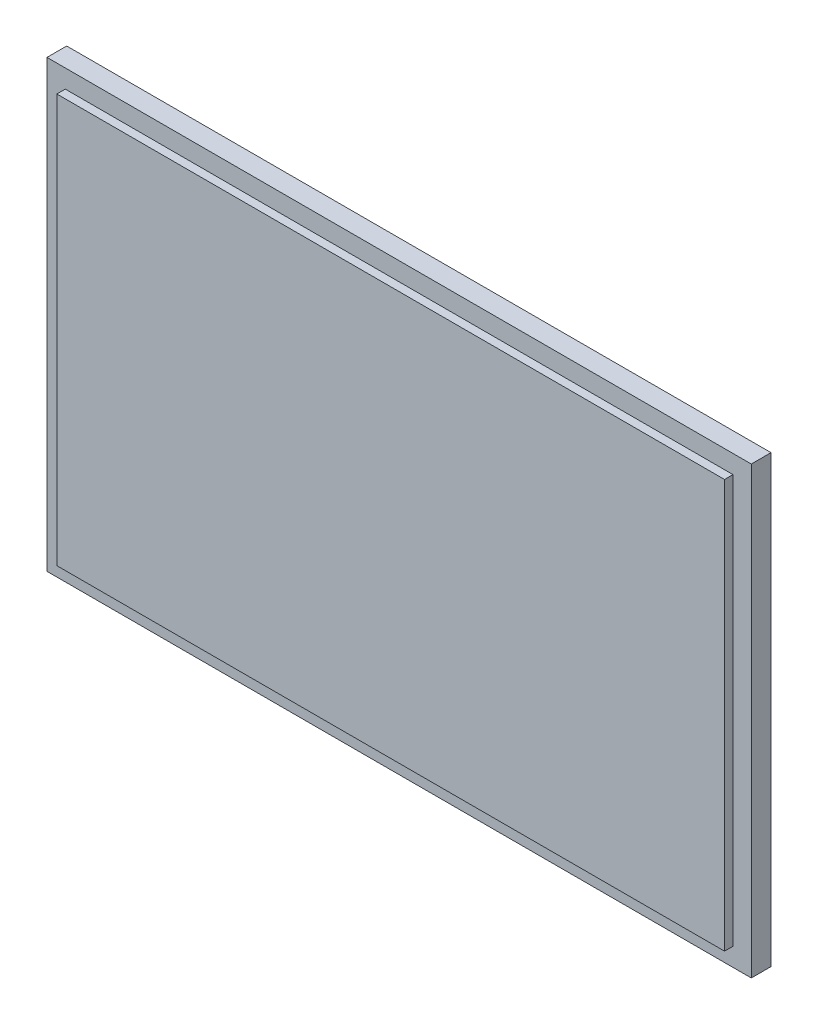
SolidWorks part; units mm, degrees
ref_plane "Plan de face" through (0, 0, 0) normal (0, 0, 1) x (1, 0, 0)
ref_plane "Plan de dessus" through (0, 0, 0) normal (0, 1, 0) x (1, 0, 0)
ref_plane "Plan de droite" through (0, 0, 0) normal (1, 0, 0) x (0, 0, -1)
sketch "Esquisse1" plane through (0, 0, 0) normal (0, 0, 1) x (1, 0, 0)
  line L1 (-98.7408, 66.9983) -> (151.2592, 66.9983)
  line L2 (-98.7408, 66.9983) -> (-98.7408, -91.0017)
  line L3 (-98.7408, -91.0017) -> (151.2592, -91.0017)
  line L4 (151.2592, 66.9983) -> (151.2592, -91.0017)
  dimension "D1" = 250
  dimension "D2" = 158
extrude "Boss.-Extru.1" add sketch "Esquisse1" along normal blind 10
sketch "Esquisse3" plane through (0, 0, 10) normal (0, 0, 1) x (1, 0, 0)
  line L0 (151.2592, -91.0017) -> (151.2592, 66.9983) construction
  line L1 (-98.7408, 66.9983) -> (151.2592, 66.9983)
  line L2 (-98.7408, 66.9983) -> (-98.7408, 60.4983)
  line L3 (-98.7408, 60.4983) -> (151.2592, 60.4983)
  line L4 (151.2592, 66.9983) -> (151.2592, 60.4983)
  dimension "D1" = 6.5
extrude "Enlèv. mat.-Extru.1" cut sketch "Esquisse3" against normal blind 3
sketch "Esquisse4" plane through (0, 0, 10) normal (0, 0, 1) x (1, 0, 0)
  line L0 (-98.7408, 60.4983) -> (-98.7408, -91.0017) construction
  line L1 (151.2592, -91.0017) -> (-98.7408, -91.0017)
  line L2 (151.2592, -91.0017) -> (151.2592, -84.5017)
  line L3 (151.2592, -84.5017) -> (-98.7408, -84.5017)
  line L4 (-98.7408, -91.0017) -> (-98.7408, -84.5017)
  dimension "D1" = 6.5
extrude "Enlèv. mat.-Extru.2" cut sketch "Esquisse4" against normal blind 3
sketch "Esquisse5" plane through (0, 0, 10) normal (0, 0, 1) x (1, 0, 0)
  line L0 (151.2592, -84.5017) -> (-98.7408, -84.5017) construction
  line L1 (-98.7408, 60.4983) -> (-92.2408, 60.4983)
  line L2 (-98.7408, 60.4983) -> (-98.7408, -84.5017)
  line L3 (-98.7408, -84.5017) -> (-92.2408, -84.5017)
  line L4 (-92.2408, 60.4983) -> (-92.2408, -84.5017)
  line L6 (151.2592, 60.4983) -> (144.7592, 60.4983)
  line L7 (151.2592, 60.4983) -> (151.2592, -84.5017)
  line L8 (151.2592, -84.5017) -> (144.7592, -84.5017)
  line L9 (144.7592, 60.4983) -> (144.7592, -84.5017)
  dimension "D1" = 6.5
  dimension "D2" = 6.5
extrude "Enlèv. mat.-Extru.3" cut sketch "Esquisse5" against normal blind 3
